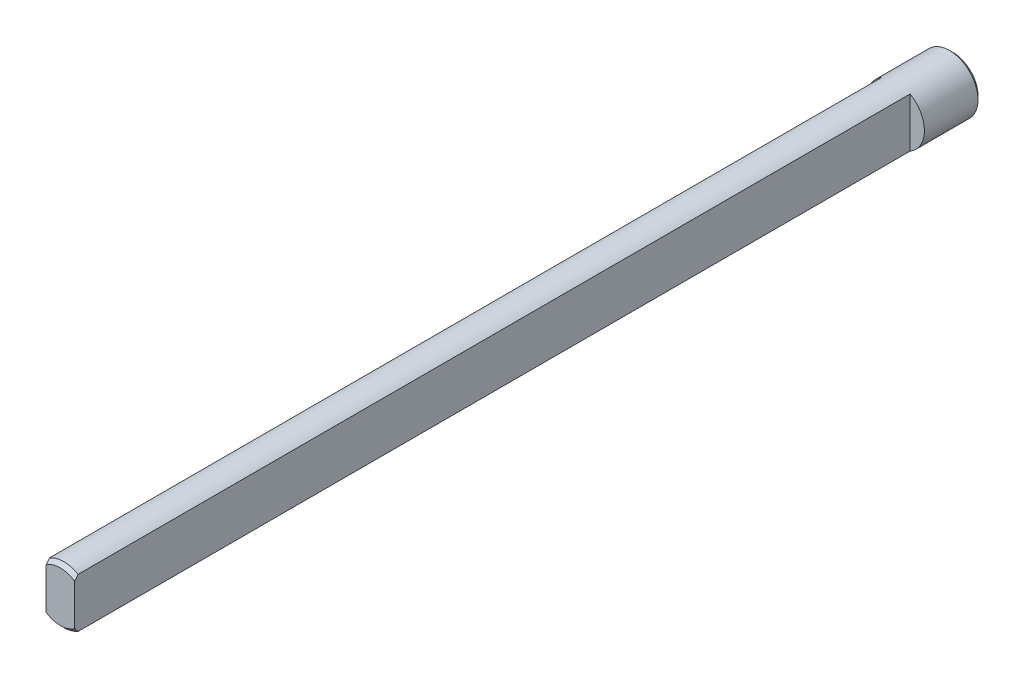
SolidWorks part; units mm, degrees
ref_plane "Plan de face" through (0, 0, 0) normal (0, 0, 1) x (1, 0, 0)
ref_plane "Plan de dessus" through (0, 0, 0) normal (0, 1, 0) x (1, 0, 0)
ref_plane "Plan de droite" through (0, 0, 0) normal (1, 0, 0) x (0, 0, -1)
sketch "Esquisse1" plane through (0, 0, 0) normal (0, 0, 1) x (1, 0, 0)
  circle A0 centre (0, 0) radius 4
  dimension "D1" = 8
extrude "Boss.-Extru.1" add sketch "Esquisse1" along normal blind 125
chamfer "Chanfrein1" distance 0.5 angle 45 2 edges at (4, 0, 0) (4, 0, 125)
sketch "Esquisse3" plane through (0, 0, 0) normal (0, 0, -1) x (-1, 0, 0)
  line L2 (-2, 3.4641) -> (-2, -3.4641)
  line L4 (2, 3.4641) -> (2, -3.4641)
  circle A0 centre (0, 0) radius 4 construction
  arc A1 (-2, 3.4641) -> (-2, -3.4641) centre (0, 0) ccw
  arc A2 (2, -3.4641) -> (2, 3.4641) centre (0, 0) ccw
  dimension "D1" = 4
  dimension "D2" = 2
extrude "Enlèv. mat.-Extru.1" cut sketch "Esquisse3" against normal blind 122 from offset 8
hole_wizard "Trou taraudé M41" positions "Esquisse5" profile "Esquisse4" tap size "M4" standard "ISO"
sketch "Esquisse5" plane through (0, 0, 0) normal (0, 0, -1) x (-1, 0, 0)
  point P0 (0, 0)
sketch "Esquisse4" plane through (0, 0, 0) normal (1, 0, 0) x (0, 1, 0)
  line L0 (0, 0) -> (0, 19.4914)
  line L1 (0, 19.4914) -> (1.65, 18.5)
  line L2 (1.65, 18.5) -> (1.65, 0)
  line L5 (1.65, 0) -> (0, 0)
  line L10 (0, 19.4914) -> (-1.65, 18.5) construction
  line L11 (0, -6.35) -> (0, 107.95) construction
  dimension "Diamètre du trou pour taraudage" = 3.3
  dimension "Profondeur du trou pour taraudage" = 18.5
  dimension "Angle de pointe" = 118
